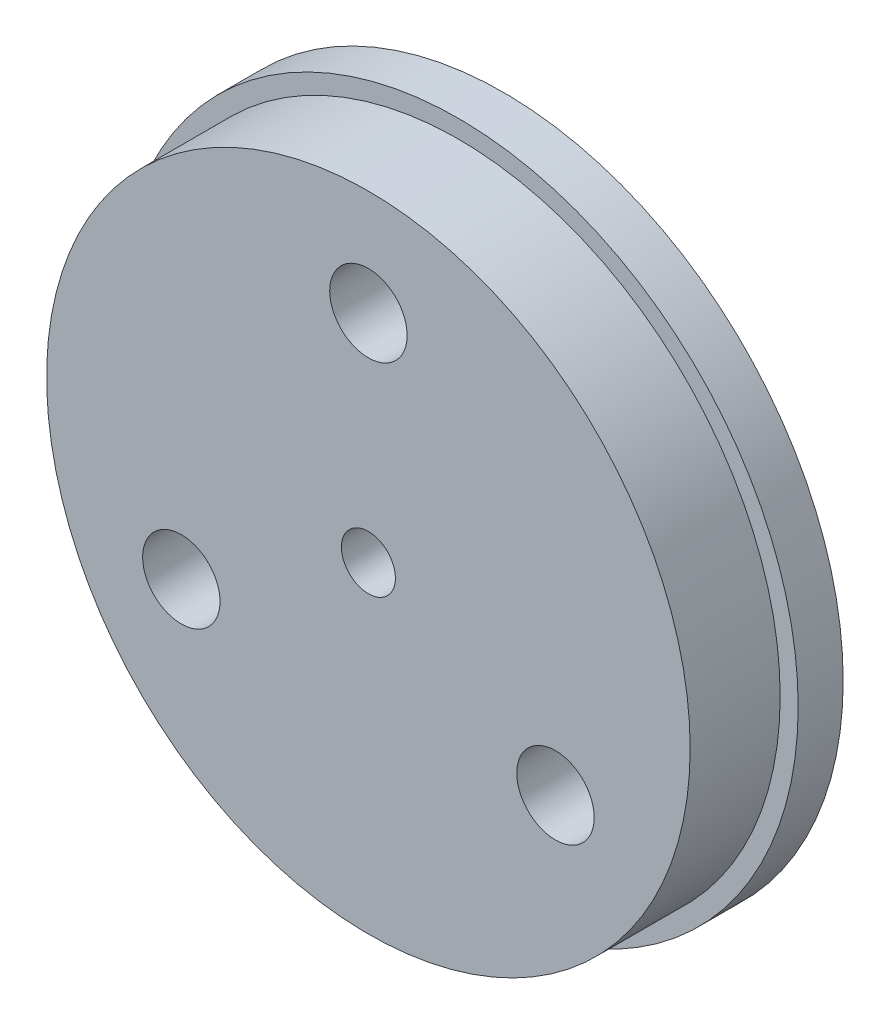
SolidWorks part; units mm, degrees
ref_plane "Alzado" through (0, 0, 0) normal (0, 0, 1) x (1, 0, 0)
ref_plane "Planta" through (0, 0, 0) normal (0, 1, 0) x (1, 0, 0)
ref_plane "Vista lateral" through (0, 0, 0) normal (1, 0, 0) x (0, 0, -1)
sketch "Sketch1" plane through (0, 0, 0) normal (0, 0, 1) x (1, 0, 0)
  circle A0 centre (0, 0) radius 37.75
  circle A1 centre (0, 0) radius 3
  circle A2 centre (0, 24) radius 4.3
  circle A3 centre (20.7846, -12) radius 4.3
  circle A4 centre (-20.7846, -12) radius 4.3
  point P13 (0, 0)
  dimension "D1" = 75.5
  dimension "D2" = 6
  dimension "D3" = 8.6
  dimension "D4" = 24
  dimension "D5" = 3
extrude "Boss-Extrude1" add sketch "Sketch1" along normal blind 5
sketch "Sketch2" plane through (0, 0, 0) normal (0, 0, -1) x (-1, 0, 0)
  line L0 (-35.0659, -12) -> (-10.0036, -12) construction
  line L9 (-27.3732, -19.852) -> (-26.2483, -18.5114)
  line L10 (-20.7846, -8.2074) -> (-20.7846, -14.3086) construction
  line L11 (-14.196, -19.852) -> (-15.3209, -18.5114)
  line L12 (-10.1431, 22.2201) -> (-8.4204, 22.5239)
  line L13 (-3.5545, 33.6318) -> (-2.9669, 32.0175)
  line L14 (24.2659, -2.3259) -> (23.6566, -3.9999)
  line L15 (30.8545, -13.7376) -> (29.1619, -13.4392)
  circle A0 centre (-20.7846, -12) radius 8.5 construction
  arc A2 (-26.2483, -18.5114) -> (-15.3209, -18.5114) centre (-20.7846, -12) ccw
  arc A4 (29.1619, -13.4392) -> (23.6566, -3.9999) centre (20.7846, -12) ccw
  arc A5 (-27.3732, -19.852) -> (-14.196, -19.852) centre (-20.7846, -12) ccw
  arc A10 (-2.9669, 32.0175) -> (-8.4204, 22.5239) centre (0, 24) ccw
  circle A11 centre (20.7846, -12) radius 4.3 construction
  arc A12 (-3.5545, 33.6318) -> (-10.1431, 22.2201) centre (-0.0488, 24) ccw
  arc A14 (30.8545, -13.7376) -> (24.2659, -2.3259) centre (20.7602, -11.9577) ccw
  point P25 (0, 0)
  point P27 (0, 0)
  point P33 (-0.0244, 0.0141)
  dimension "D1" = 17
  dimension "D4" = 1.75
  dimension "D6" = 17
  dimension "D2" = 1.75
  dimension "D7" = 1.75
  dimension "D5" = 50
  dimension "D3" = 3
sketch "Sketch4" plane through (0, 0, 0) normal (0, 0, -1) x (-1, 0, 0)
  circle A0 centre (-20.7846, -12) radius 8.75
  circle A1 centre (0, 24) radius 8.75
  circle A2 centre (20.7846, -12) radius 8.75
  point P9 (0, 0)
  dimension "D1" = 17.5
  dimension "D2" = 3
sketch "Sketch5" plane through (0, 0, 5) normal (0, 0, 1) x (1, 0, 0)
  circle A0 centre (0, 0) radius 35.75
  circle A2 centre (0, 0) radius 3
  circle A3 centre (0, 0) radius 3 construction
  circle A4 centre (-20.7846, -12) radius 4.3
  circle A5 centre (-20.7846, -12) radius 4.3 construction
  circle A6 centre (20.7846, -12) radius 4.3
  circle A7 centre (20.7846, -12) radius 4.3 construction
  circle A8 centre (0, 24) radius 4.3
  circle A9 centre (0, 24) radius 4.3 construction
  dimension "D1" = 71.5
extrude "Boss-Extrude3" add sketch "Sketch5" along normal blind 10
extrude "Cut-Extrude4" cut sketch "Sketch2" against normal blind 3
extrude "Cut-Extrude7" cut sketch "Sketch4" against normal blind 1.5
